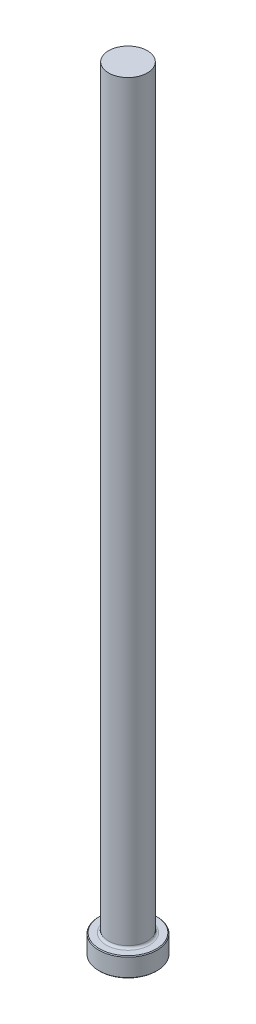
SolidWorks part; units mm, degrees
ref_plane "Front Plane" through (0, 0, 0) normal (0, 0, 1) x (1, 0, 0)
ref_plane "Top Plane" through (0, 0, 0) normal (0, 1, 0) x (1, 0, 0)
ref_plane "Right Plane" through (0, 0, 0) normal (1, 0, 0) x (0, 0, -1)
sketch "Sketch1" plane through (0, 0, 0) normal (0, 0, 1) x (1, 0, 0)
  line L0 (0, 259.9588) -> (0, -15.1925) construction
  line L1 (0, 0) -> (-9.525, 0)
  line L2 (-9.525, 0) -> (-9.525, 6.35)
  line L3 (-9.525, 6.35) -> (-6.35, 6.35)
  line L4 (-6.35, 6.35) -> (-6.35, 254)
  line L5 (-6.35, 254) -> (0, 254)
  line L6 (0, 254) -> (0, 0)
  dimension "L" = 254
  dimension "H" = 19.05
  dimension "T" = 6.35
  dimension "D" = 12.7
revolve "Revolve1" add sketch "Sketch1" angle 360 about L0
chamfer "Chamfer1" distance 0.254 angle 45 2 edges at (0, 6.35, 9.525) (0, 0, 9.525)
fillet "Fillet1" radius 0.762 1 edges at (0, 6.35, 6.35)
sketch "Pocket Sketch" plane through (0, 0, 0) normal (0, 0, 1) x (1, 0, 0)
  line L0 (-9.9219, 0) -> (-9.9219, 6.3754)
  line L1 (-9.9219, 6.3754) -> (-7.5089, 6.3754)
  line L2 (-6.7469, 7.1374) -> (-6.7469, 22.225)
  line L3 (-6.7469, 22.225) -> (0, 22.225)
  line L4 (0, 22.225) -> (0, 0)
  line L5 (0, 0) -> (-9.9219, 0)
  line L6 (0, 12.6104) -> (0, -2.4989) construction
  line L7 (-9.525, 6.096) -> (-9.525, 0.254) construction
  line L8 (9.271, 6.35) -> (-9.271, 6.35) construction
  line L9 (-6.35, 254) -> (-6.35, 7.112) construction
  line L10 (-7.5089, 6.3754) -> (-6.7469, 7.1374)
  point P3 (-6.7469, 6.3754)
  dimension "D1" = 19.8437
  dimension "D2" = 0.3969
  dimension "D3" = 0.0254
  dimension "D4" = 0.3969
  dimension "D5" = 13.4937
  dimension "D6" = 22.225
